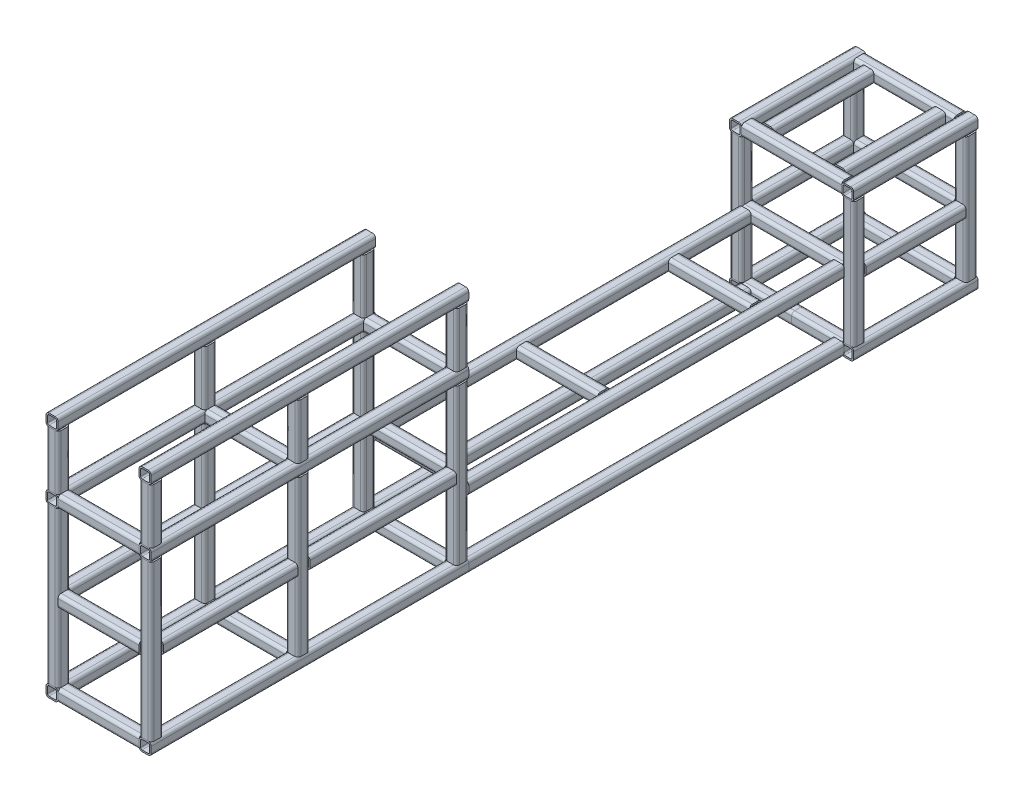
SolidWorks part; units mm, degrees
ref_plane "Front Plane" through (0, 0, 0) normal (0, 0, 1) x (1, 0, 0)
ref_plane "Top Plane" through (0, 0, 0) normal (0, 1, 0) x (1, 0, 0)
ref_plane "Right Plane" through (0, 0, 0) normal (1, 0, 0) x (0, 0, -1)
sketch3d "3DSketch1"
  line L0 (-51, 0, 0) -> (389, 0, 0)
  line L1 (389, 0, 0) -> (389, 701.3682, 0)
  line L2 (-51, 0, 0) -> (-51, 701.3682, 0)
  line L3 (-51, 701.3682, 0) -> (389, 701.3682, 0)
  line L4 (389, 0, 0) -> (389, 0, -1328)
  line L5 (389, 0, -1328) -> (389, 701.3682, -1328)
  line L6 (389, 701.3682, -1328) -> (389, 701.3682, 0)
  line L7 (-51, 0, 0) -> (-51, 0, -1328)
  line L8 (-51, 0, -1328) -> (-51, 701.3682, -1328)
  line L9 (-51, 701.3682, -1328) -> (-51, 701.3682, 0)
  line L10 (-51, 0, -1328) -> (389, 0, -1328)
  line L11 (-51, 701.3682, -1328) -> (389, 701.3682, -1328)
  line L12 (389, 0, -664) -> (-51, 0, -664)
  line L13 (-51, 0, -664) -> (-51, 701.3682, -664)
  line L14 (-51, 701.3682, -664) -> (389, 701.3682, -664)
  line L15 (389, 701.3682, -664) -> (389, 0, -664)
  line L16 (428.8617, 0, -3417.8617) -> (428.8617, 0, -2898.1383)
  line L17 (428.8617, 0, -3417.8617) -> (-90.8617, 0, -3417.8617)
  line L18 (-90.8617, 0, -3417.8617) -> (-90.8617, 0, -2898.1383)
  line L19 (428.8617, 0, -2898.1383) -> (169, 0, -2898.1383)
  line L20 (428.8617, 0, -3417.8617) -> (428.8617, 578.7, -3417.8617)
  line L21 (428.8617, 578.7, -3417.8617) -> (-90.8617, 578.7, -3417.8617)
  line L22 (-90.8617, 578.7, -3417.8617) -> (-90.8617, 0, -3417.8617)
  line L23 (428.8617, 0, -2898.1383) -> (428.8617, 578.7, -2898.1383)
  line L24 (428.8617, 578.7, -2898.1383) -> (-90.8617, 578.7, -2898.1383)
  line L25 (-90.8617, 578.7, -2898.1383) -> (-90.8617, 0, -2898.1383)
  line L26 (-90.8617, 578.7, -2898.1383) -> (-90.8617, 578.7, -3417.8617)
  line L27 (428.8617, 578.7, -2898.1383) -> (428.8617, 578.7, -3417.8617)
  line L28 (169, 0, 0) -> (169, 0, -2898.1383) construction
  line L29 (389, 340.9341, 0) -> (389, 340.9341, -664)
  line L30 (389, 340.9341, -664) -> (389, 340.9341, -1328)
  line L31 (389, 340.9341, -1328) -> (-51, 340.9341, -1328)
  line L32 (-51, 340.9341, -1328) -> (-51, 340.9341, -664)
  line L33 (-51, 340.9341, -664) -> (-51, 340.9341, 0)
  line L34 (-51, 340.9341, 0) -> (389, 340.9341, 0)
  line L35 (389, 280.9341, -1328) -> (389, 280.9341, -2898.1383)
  line L36 (-51, 280.9341, -1328) -> (-51, 280.9341, -2898.1383)
  line L37 (-51, 280.9341, -2898.1383) -> (389, 280.9341, -2898.1383)
  line L38 (-90.8617, 280.9341, -2898.1383) -> (-51, 280.9341, -2898.1383)
  line L39 (389, 280.9341, -2898.1383) -> (428.8617, 280.9341, -2898.1383)
  line L40 (-51, 280.9341, -1328) -> (389, 280.9341, -1328)
  line L41 (169, 0, -2898.1383) -> (169, 280.9341, -2898.1383) construction
  line L42 (169, 280.9341, -2898.1383) -> (169, 280.9341, -3158) construction
  line L43 (169, 280.9341, -3158) -> (169, 0, -3158) construction
  line L44 (169, 0, -2898.1383) -> (-90.8617, 0, -2898.1383)
  line L45 (169, 0, -2898.1383) -> (169, 0, -3417.8617) construction
  line L46 (169, 280.9341, -1328) -> (169, 0, -1328) construction
  line L47 (389, 0, -1328) -> (389, 0, -2898.1383)
  line L48 (-51, 0, -1328) -> (-51, 0, -2898.1383)
  line L49 (-90.8617, 280.9341, -2898.1383) -> (-90.8617, 280.9341, -3417.8617)
  line L50 (-90.8617, 280.9341, -3417.8617) -> (428.8617, 280.9341, -3417.8617)
  line L51 (428.8617, 280.9341, -3417.8617) -> (428.8617, 280.9341, -2898.1383)
  line L52 (428.8617, 578.7, -2898.1383) -> (-90.8617, 578.7, -3417.8617) construction
  line L53 (389, 280.9341, -2603) -> (-51, 280.9341, -2603)
  line L54 (389, 280.9341, -1968.0018) -> (-51, 280.9341, -1968.0018)
  line L55 (19, 578.7, -2898.1383) -> (19, 578.7, -3417.8617)
  line L56 (319, 578.7, -2898.1383) -> (319, 578.7, -3417.8617)
  line L57 (169, 578.7, -2898.1383) -> (169, 578.7, -3417.8617) construction
  line L58 (389, 701.3682, 0) -> (389, 981.3682, 0)
  line L59 (389, 981.3682, 0) -> (389, 981.3682, -1328)
  line L60 (389, 981.3682, -1328) -> (389, 701.3682, -1328)
  line L61 (-51, 701.3682, 0) -> (-51, 981.3682, 0)
  line L62 (-51, 981.3682, 0) -> (-51, 981.3682, -1328)
  line L63 (-51, 981.3682, -1328) -> (-51, 701.3682, -1328)
  line L64 (389, 701.3682, -664) -> (389, 981.3682, -664)
  line L65 (-51, 701.3682, -664) -> (-51, 981.3682, -664)
  circle A1 centre (169, 545.8682, -3158) radius 120 construction
  point P50 (169, 425.8682, -3158)
  dimension "D10" = 300
  dimension "D1" = 1328
  dimension "D2" = 360.4341
  dimension "D8" = 1275
  dimension "D3" = 440
  dimension "D4" = 735
  dimension "D5" = 340.9341
  dimension "D6" = 60
  dimension "D7" = 297.7659
  dimension "D9" = 640
  dimension "D11" = 150
  dimension "D12" = 280
other "Structural Member1"
ref_plane "Plane2" through (-51, 701.3682, -1328) normal (0, 0, 1) x (1, 0, 0)
sketch "Sketch1" plane through (-51, 701.3682, -1328) normal (0, 0, 1) x (1, 0, 0)
  line L0 (-12.7, -19.05) -> (12.7, -19.05)
  line L1 (-19.05, -12.7) -> (-19.05, 12.7)
  line L2 (12.7, 19.05) -> (-12.7, 19.05)
  line L3 (19.05, 12.7) -> (19.05, -12.7)
  line L4 (-12.7, -25.4) -> (12.7, -25.4)
  line L5 (-25.4, -12.7) -> (-25.4, 12.7)
  line L6 (12.7, 25.4) -> (-12.7, 25.4)
  line L7 (25.4, 12.7) -> (25.4, -12.7)
  line L8 (0, 0) -> (19.05, 0) construction
  line L9 (0, 0) -> (0, 19.05) construction
  arc A0 (25.4, 12.7) -> (12.7, 25.4) centre (12.7, 12.7) ccw
  arc A1 (12.7, -25.4) -> (25.4, -12.7) centre (12.7, -12.7) ccw
  arc A2 (-25.4, -12.7) -> (-12.7, -25.4) centre (-12.7, -12.7) ccw
  arc A3 (-12.7, 25.4) -> (-25.4, 12.7) centre (-12.7, 12.7) ccw
  arc A4 (-12.7, 19.05) -> (-19.05, 12.7) centre (-12.7, 12.7) ccw
  arc A5 (19.05, 12.7) -> (12.7, 19.05) centre (12.7, 12.7) ccw
  arc A6 (12.7, -19.05) -> (19.05, -12.7) centre (12.7, -12.7) ccw
  arc A7 (-19.05, -12.7) -> (-12.7, -19.05) centre (-12.7, -12.7) ccw
  point P3 (0, 25.4)
  point P4 (25.4, 0)
  point P5 (0, -25.4)
  point P6 (-25.4, 0)
  point P7 (-25.4, 25.4)
  point P8 (-25.4, -25.4)
  point P33 (0, 0)
  point P35 (25.4, -25.4)
  point P36 (25.4, 25.4)
  point P37 (0, 0)
  dimension "D1" = 12.7
  dimension "Thickness" = 6.35
  dimension "V_leg" = 50.8
delete or keep bodies "Body-Delete1" type delete bodies bodies 133 135
other "Trim/Extend3"
equation "\"D11@3DSketch1\" = \"D10@3DSketch1\"/2"
